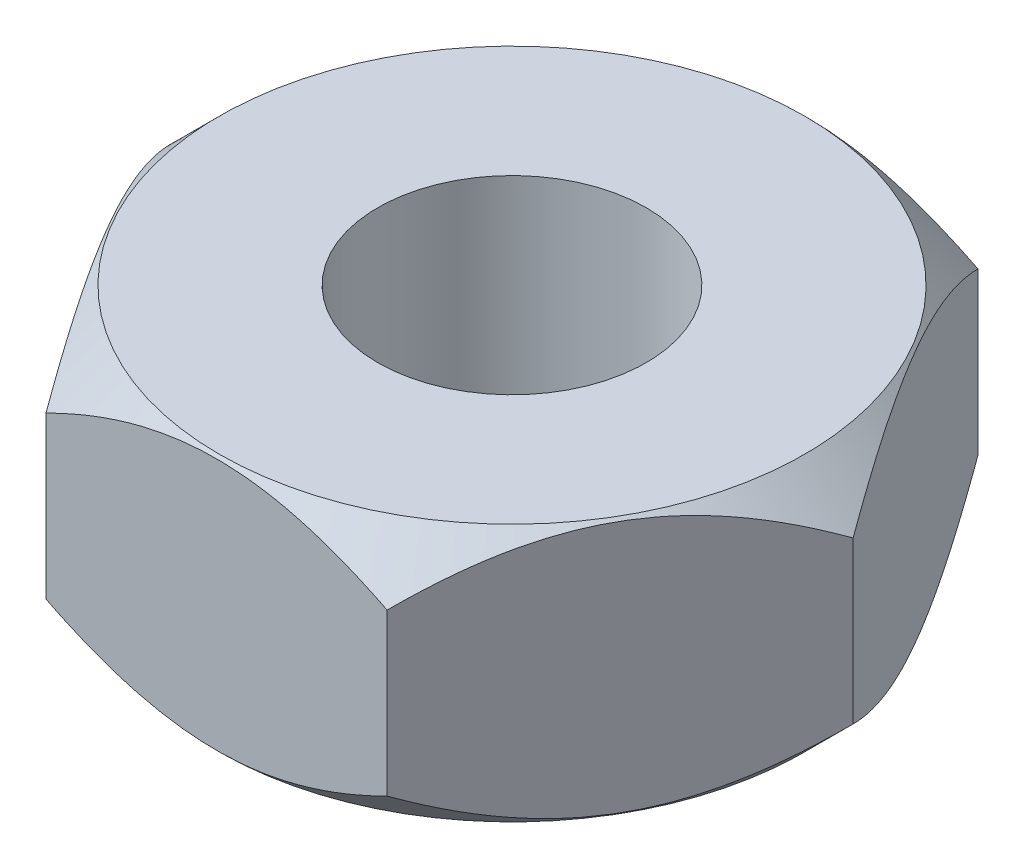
SolidWorks part; units mm, degrees
ref_plane "Aufriss" through (0, 0, 0) normal (0, 0, 1) x (1, 0, 0)
ref_plane "Grundriss" through (0, 0, 0) normal (0, 1, 0) x (1, 0, 0)
ref_plane "Seitenriss" through (0, 0, 0) normal (1, 0, 0) x (0, 0, -1)
sketch "Skizze1" plane through (0, 0, 0) normal (0, 1, 0) x (1, 0, 0)
  line L1 (1.5877, 2.75) -> (-1.5877, 2.75)
  line L2 (-1.5877, 2.75) -> (-3.1754, 0)
  line L3 (-3.1754, 0) -> (-1.5877, -2.75)
  line L4 (-1.5877, -2.75) -> (1.5877, -2.75)
  line L5 (1.5877, -2.75) -> (3.1754, 0)
  line L6 (3.1754, 0) -> (1.5877, 2.75)
  circle A0 centre (0, 0) radius 2.75 construction
  dimension "D1" = 5.5
extrude "Aufsatz-Linear austragen1" add sketch "Skizze1" along normal blind 2.4
hole_wizard "Ø1.0 (1) Durchmesser Bohrung1" positions "Skizze3" profile "Skizze2" hole size "Ø1.0" standard "DIN"
sketch "Skizze3" plane through (0, 2.4, 0) normal (0, 1, 0) x (1, 0, 0)
  point P0 (0, 0)
sketch "Skizze2" plane through (0, 2.4, 0) normal (1, 0, 0) x (0, 0, 1)
  line L0 (0, 0) -> (0, 2.4)
  line L1 (0, 2.4) -> (1.25, 2.4)
  line L2 (1.25, 2.4) -> (1.25, 0)
  line L5 (1.25, 0) -> (0, 0)
  line L11 (0, -6.35) -> (0, 107.95) construction
  dimension "Bohrerdurchmesser" = 2.5
  dimension "Bohrungstiefe" = 2.4
sketch "Skizze4" plane through (0, 0, 0) normal (0, 0, 1) x (1, 0, 0)
  line L0 (-3.1754, 1.95) -> (-2.7254, 2.4)
  line L1 (-3.1754, 2.4) -> (-3.1754, 0) construction
  line L2 (-2.7254, 2.4) -> (-3.1754, 2.4)
  line L3 (-3.1754, 2.4) -> (-3.1754, 1.95)
  line L4 (-3.1754, 0) -> (-2.7254, 0)
  line L5 (-2.7254, 0) -> (-3.1754, 0.45)
  line L6 (-3.1754, 0.45) -> (-3.1754, 0)
  line L7 (0, 0) -> (0, 1.3263) construction
  dimension "D1" = 45
  dimension "D2" = 45
  dimension "D3" = 0.45
revolve "Schnitt-Rotation1" cut sketch "Skizze4" angle 360 about L7
